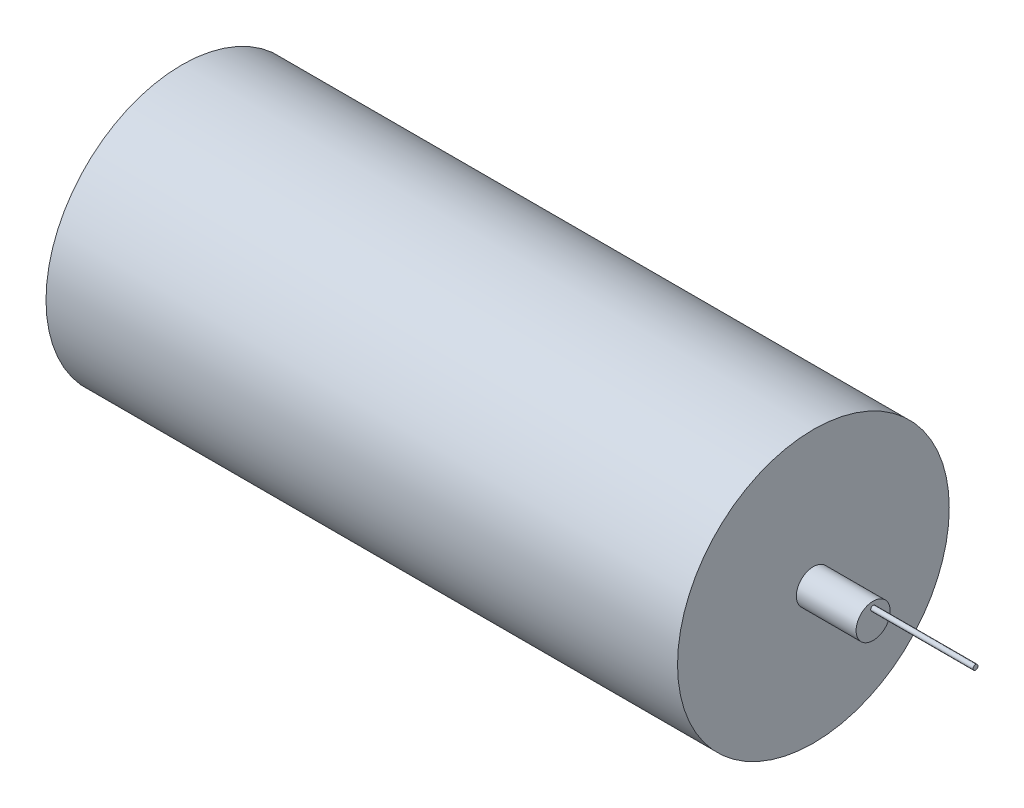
SolidWorks part; units mm, degrees
ref_plane "Front Plane" through (0, 0, 0) normal (0, 0, 1) x (1, 0, 0)
ref_plane "Top Plane" through (0, 0, 0) normal (0, 1, 0) x (1, 0, 0)
ref_plane "Right Plane" through (0, 0, 0) normal (1, 0, 0) x (0, 0, -1)
sketch "Sketch1" plane through (0, 0, 0) normal (1, 0, 0) x (0, 0, -1)
  circle A0 centre (0, 0) radius 199
  circle A1 centre (0, 0) radius 195
extrude "Boss-Extrude1" add sketch "Sketch1" along normal mid plane 925
sketch "Sketch2" plane through (462.5, 0, 0) normal (1, 0, 0) x (0, 0, -1)
  circle A0 centre (0, 0) radius 195
  circle A1 centre (0, 0) radius 25
extrude "Boss-Extrude2" add sketch "Sketch2" against normal blind 5
mirror "Mirror1" about plane through (0, 0, 0) normal (1, 0, 0) of "Boss-Extrude2"
sketch "Sketch3" plane through (0, 0, 0) normal (1, 0, 0) x (0, 0, -1)
  circle A0 centre (0, 0) radius 25
extrude "Boss-Extrude3" add sketch "Sketch3" along normal mid plane 1100
sketch "Sketch4" plane through (550, 0, 0) normal (1, 0, 0) x (0, 0, -1)
  circle A0 centre (0, 15.9576) radius 3.5883
extrude "Boss-Extrude4" add sketch "Sketch4" along normal blind 150
